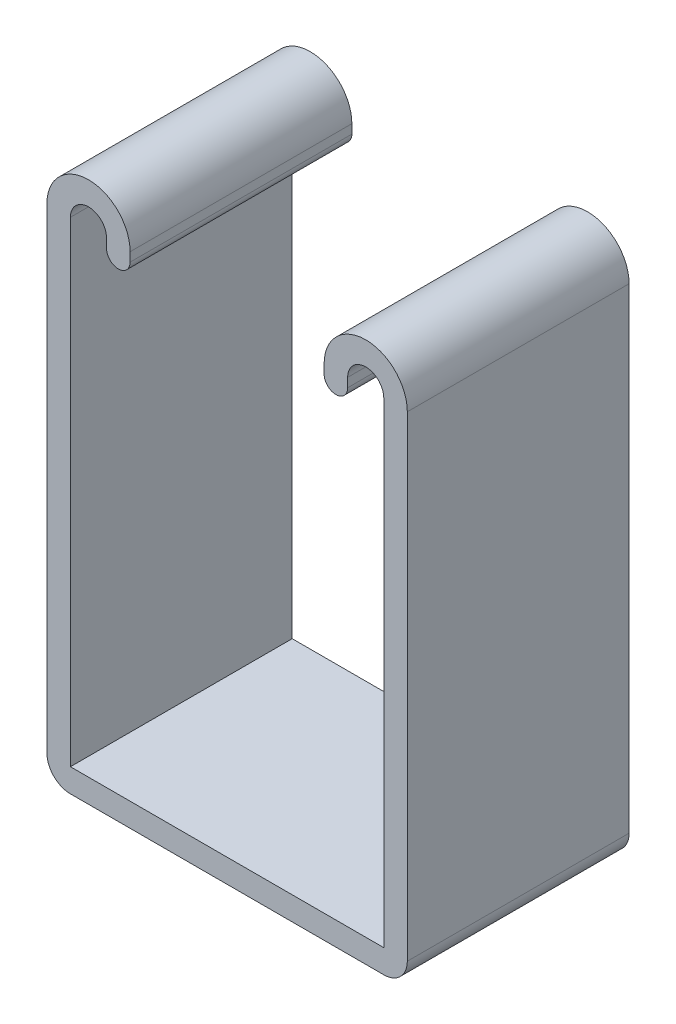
SolidWorks part; units mm, degrees
ref_plane "Plane1" through (0, 0, 0) normal (0, 0, 1) x (1, 0, 0)
ref_plane "Plane2" through (0, 0, 0) normal (0, 1, 0) x (1, 0, 0)
ref_plane "Plane3" through (0, 0, 0) normal (1, 0, 0) x (0, 0, -1)
sketch "Sketch1" plane through (0, 0, 0) normal (0, 0, 1) x (1, 0, 0)
  line L0 (-20.6375, 29.1719) -> (-20.6375, -25.3238)
  line L1 (-17.9451, -28.0162) -> (17.9451, -28.0162)
  line L2 (20.6375, -25.3238) -> (20.6375, 29.1719)
  line L3 (11.1125, 29.1719) -> (11.1125, 28.1369)
  line L4 (-11.1125, 29.1719) -> (-11.1125, 28.1369)
  line L5 (-13.8049, 29.1719) -> (-13.8049, 28.1369)
  line L6 (-17.9451, 29.1719) -> (-17.9451, -25.3238)
  line L7 (-17.9451, -25.3238) -> (17.9451, -25.3238)
  line L8 (17.9451, -25.3238) -> (17.9451, 29.1719)
  line L9 (13.8049, 29.1719) -> (13.8049, 28.1369)
  line L10 (-25.4, 33.9344) -> (25.4, 33.9344) construction
  line L11 (-12.8524, 26.7907) -> (12.8524, 26.7907) construction
  arc A0 (20.6375, 29.1719) -> (11.1125, 29.1719) centre (15.875, 29.1719) ccw
  arc A1 (-20.6375, 29.1719) -> (-11.1125, 29.1719) centre (-15.875, 29.1719) cw
  arc A2 (-17.9451, -28.0162) -> (-20.6375, -25.3238) centre (-17.9451, -25.3238) cw
  arc A3 (17.9451, -28.0162) -> (20.6375, -25.3238) centre (17.9451, -25.3238) ccw
  arc A4 (-17.9451, 29.1719) -> (-13.8049, 29.1719) centre (-15.875, 29.1719) cw
  arc A5 (17.9451, 29.1719) -> (13.8049, 29.1719) centre (15.875, 29.1719) ccw
  arc A6 (11.1125, 28.1369) -> (13.8049, 28.1369) centre (12.4587, 28.1369) ccw
  arc A7 (-11.1125, 28.1369) -> (-13.8049, 28.1369) centre (-12.4587, 28.1369) cw
  dimension "D1" = 2.6924
  dimension "D3" = 20.6375
  dimension "Width" = 41.275
  dimension "D5" = 28.0162
  dimension "D6" = 9.525
  dimension "D7" = 22.225
  dimension "D8" = 33.9344
  dimension "D9" = 7.1437
  dimension "gauge" = 2.6924
extrude "Base-Extrude" add sketch "Sketch1" along normal mid plane 25.4
equation "\"D3@Sketch1\" = \"Width@Sketch1\" / 2"
equation "\"D7@Sketch1\" = \"Width@Sketch1\" - 2 * \"D6@Sketch1\""
equation "\"D1@Sketch1\" = \"gauge@Sketch1\""
